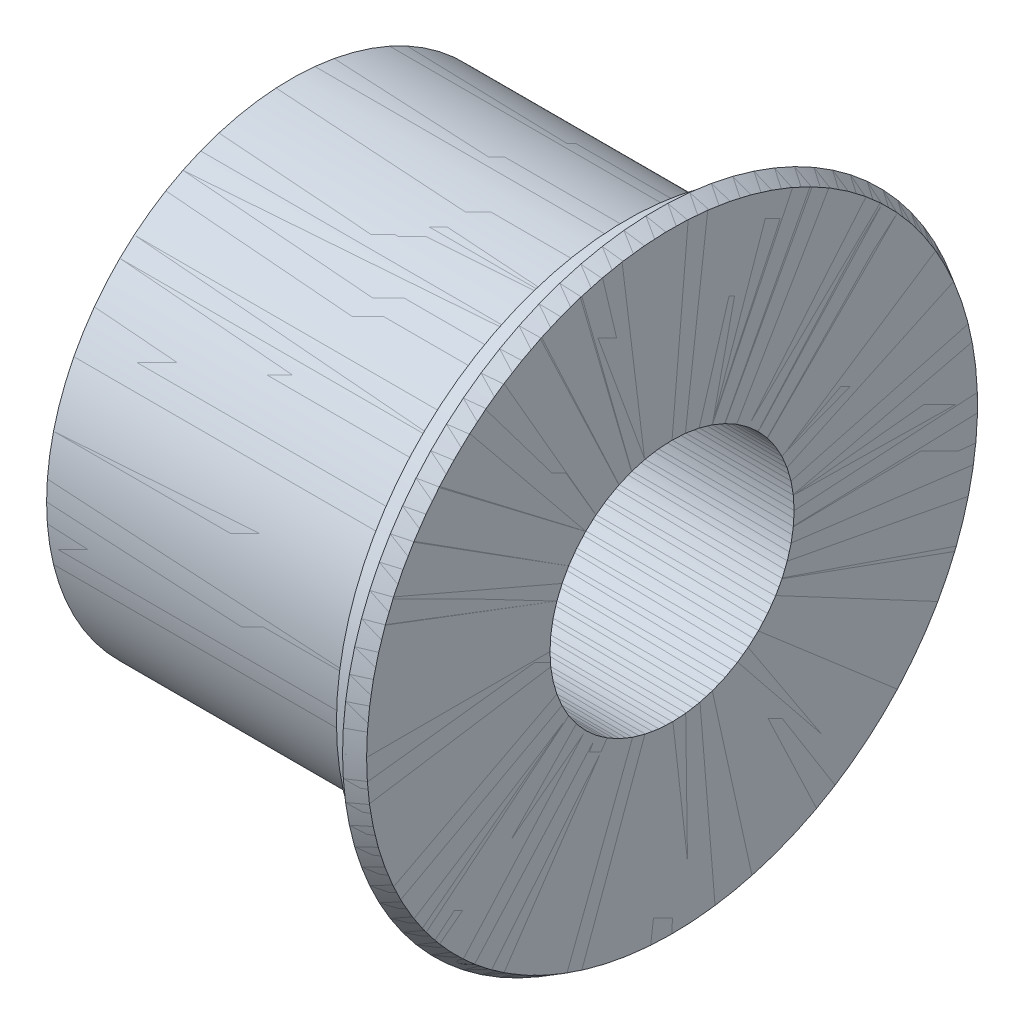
SolidWorks part; units mm, degrees
ref_plane "Face" through (0, 0, 0) normal (0, 0, 1) x (1, 0, 0)
ref_plane "Dessus" through (0, 0, 0) normal (0, 1, 0) x (1, 0, 0)
ref_plane "Droite" through (0, 0, 0) normal (1, 0, 0) x (0, 0, -1)
imported_body "Importée1"
sketch "Esquisse1" plane through (25, 0, 0) normal (1, 0, 0) x (0, 0, -1)
  line L0 (0, 0) -> (-16.1387, -18.1182)
  line L1 (-16.1387, -18.1182) -> (-15.7654, -18.4508)
  line L2 (-15.7654, -18.4508) -> (0.3734, -0.3326)
  line L3 (0.3734, -0.3326) -> (0, 0)
  dimension "D1" = 0.5
revolve "Enlèvement de matière-Révolution1" cut sketch "Esquisse1" angle 360 about L0
